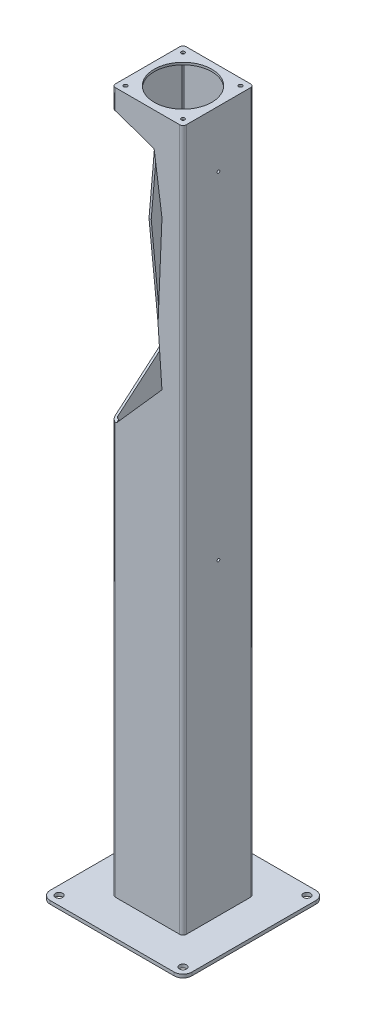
SolidWorks part; units mm, degrees
ref_plane "Front Plane" through (0, 0, 0) normal (0, 0, 1) x (1, 0, 0)
ref_plane "Top Plane" through (0, 0, 0) normal (0, 1, 0) x (1, 0, 0)
ref_plane "Right Plane" through (0, 0, 0) normal (1, 0, 0) x (0, 0, -1)
sketch "Sketch1" plane through (0, 0, 0) normal (0, 1, 0) x (1, 0, 0)
  line L1 (-88.9, 101.6) -> (88.9, 101.6)
  line L2 (-101.6, 88.9) -> (-101.6, -88.9)
  line L3 (-88.9, -101.6) -> (88.9, -101.6)
  line L4 (101.6, 88.9) -> (101.6, -88.9)
  arc A0 (-101.6, -88.9) -> (-88.9, -101.6) centre (-88.9, -88.9) ccw
  arc A1 (88.9, -101.6) -> (101.6, -88.9) centre (88.9, -88.9) ccw
  arc A2 (88.9, 101.6) -> (101.6, 88.9) centre (88.9, 88.9) cw
  arc A3 (-88.9, 101.6) -> (-101.6, 88.9) centre (-88.9, 88.9) ccw
  circle A4 centre (-88.9, 88.9) radius 5.207
  circle A5 centre (88.9, 88.9) radius 5.207
  circle A6 centre (88.9, -88.9) radius 5.207
  circle A7 centre (-88.9, -88.9) radius 5.207
  point P4 (0, 101.6)
  point P5 (-101.6, 0)
  point P9 (-101.6, -101.6)
  point P16 (-101.6, 101.6)
  dimension "D2" = 12.7
  dimension "D3" = 10.414
  dimension "D1" = 203.2
extrude "Boss-Extrude1" add sketch "Sketch1" along normal blind 4.7752
sketch "Sketch2" plane through (0, 4.7752, 0) normal (0, 1, 0) x (1, 0, 0)
  line L1 (-45.974, 50.8) -> (45.974, 50.8)
  line L2 (-50.8, 45.974) -> (-50.8, -45.974)
  line L3 (-45.974, -50.8) -> (45.974, -50.8)
  line L4 (50.8, 45.974) -> (50.8, -45.974)
  arc A0 (45.974, -50.8) -> (50.8, -45.974) centre (45.974, -45.974) ccw
  arc A1 (-50.8, -45.974) -> (-45.974, -50.8) centre (-45.974, -45.974) ccw
  arc A2 (-45.974, 50.8) -> (-50.8, 45.974) centre (-45.974, 45.974) ccw
  arc A3 (45.974, 50.8) -> (50.8, 45.974) centre (45.974, 45.974) cw
  point P8 (-50.8, -50.8)
  point P11 (-50.8, 50.8)
  point P14 (0, 50.8)
  point P16 (-50.8, 0)
  dimension "D2" = 4.826
  dimension "D1" = 101.6
extrude "Boss-Extrude2" add sketch "Sketch2" along normal blind 1005.84
shell "Shell2" thickness 3.175
sketch "Sketch3" plane through (0, 1010.6152, 0) normal (0, 1, 0) x (1, 0, 0)
  circle A0 centre (0, 0) radius 41.275
  dimension "D1" = 82.55
extrude "Cut-Extrude1" cut sketch "Sketch3" against normal through all
hole_wizard "Tap Drill for 1/4-20 Tap1" positions "Sketch4" profile "Sketch5" hole size "1/4-20" standard "ANSI Inch"
sketch "Sketch4" plane through (0, 1010.6152, 0) normal (0, 1, 0) x (1, 0, 0)
  line L0 (-41.275, -41.275) -> (-41.275, 41.275) construction
  line L1 (-41.275, 41.275) -> (41.275, 41.275) construction
  point P0 (-41.275, 41.275)
  point P2 (41.275, 41.275)
  point P4 (41.275, -41.275)
  point P6 (-41.275, -41.275)
  point P21 (-41.275, 0)
  point P22 (0, 41.275)
  dimension "D1" = 82.55
  dimension "D2" = 82.55
sketch "Sketch5" plane through (-41.275, 1010.6152, -41.275) normal (1, 0, 0) x (0, 0, 1)
  line L0 (0, 0) -> (0, 1010.6152)
  line L1 (0, 1010.6152) -> (2.5527, 1010.6152)
  line L2 (2.5527, 1010.6152) -> (2.5527, 0)
  line L5 (2.5527, 0) -> (0, 0)
  line L11 (0, -6.35) -> (0, 107.95) construction
  dimension "Thru Hole Dia." = 5.1054
  dimension "Thru Hole Depth" = 1010.6152
hole_wizard "Tap Drill for #10-32 Tap1" positions "Sketch6" profile "Sketch7" hole size "#10-32" standard "ANSI Inch"
sketch "Sketch6" plane through (50.8, 0, 0) normal (1, 0, 0) x (0, 0, -1)
  line L0 (-45.974, 1010.6152) -> (45.974, 1010.6152) construction
  point P0 (0, 929.3352)
  point P2 (0, 446.7352)
  dimension "D1" = 81.28
  dimension "D2" = 482.6
sketch "Sketch7" plane through (50.8, 929.3352, 0) normal (0, 1, 0) x (0, 0, -1)
  line L0 (0, 0) -> (0, 3.175)
  line L1 (0, 3.175) -> (2.0193, 3.175)
  line L2 (2.0193, 3.175) -> (2.0193, 0)
  line L5 (2.0193, 0) -> (0, 0)
  line L11 (0, -6.35) -> (0, 107.95) construction
  dimension "Thru Hole Dia." = 4.0386
  dimension "Thru Hole Depth" = 3.175
sketch "Sketch13" plane through (-50.8, 0, 0) normal (-1, 0, 0) x (0, 0, 1)
  line L0 (50.8, 981.7342) -> (6.8297, 968.3337)
  line L1 (50.8, 1010.6152) -> (50.8, 4.7752) construction
  line L2 (6.8297, 968.3337) -> (-10.8936, 913.4347)
  line L3 (-10.8936, 913.4347) -> (-2.032, 819.6309)
  line L4 (-2.032, 819.6309) -> (-17.81, 653.6371)
  line L5 (-17.81, 653.6371) -> (50.8, 595.0824)
  line L6 (50.8, 595.0824) -> (50.8, 981.7342)
extrude "Cut-Extrude3" cut sketch "Sketch13" against normal blind 6.35
sketch "Sketch14" plane through (0, 0, 50.8) normal (0, 0, 1) x (1, 0, 0)
  line L0 (-45.212, 981.7342) -> (9.4125, 962.2759)
  line L1 (-44.45, 981.7342) -> (-45.974, 981.7342) construction
  line L2 (9.4125, 962.2759) -> (20.615, 882.4221)
  line L3 (20.615, 882.4221) -> (15.0138, 747.9379)
  line L4 (15.0138, 747.9379) -> (20.615, 668.5207)
  line L5 (20.615, 668.5207) -> (-44.45, 595.0824)
  line L6 (-44.45, 595.0824) -> (-45.212, 981.7342)
extrude "Cut-Extrude4" cut sketch "Sketch14" against normal blind 6.35
sketch "Sketch8" plane through (-50.8, 0, 0) normal (-1, 0, 0) x (0, 0, 1)
  line L0 (-45.974, 1010.6152) -> (45.974, 1010.6152) construction
  circle A0 centre (0, 929.3352) radius 26.543
  dimension "D1" = 53.086
  dimension "D2" = 81.28
extrude "Cut-Extrude2" [suppressed] cut sketch "Sketch8" against normal up to next
hole_wizard "Tap Drill for 1/4-20 Tap2" positions "Sketch11" profile "Sketch12" hole size "1/4-20" standard "ANSI Inch"
sketch "Sketch11" [suppressed] plane through (-50.8, 0, 0) normal (-1, 0, 0) x (0, 0, 1)
  line L0 (-34.925, 967.4352) -> (34.925, 967.4352) construction
  circle A0 centre (0, 929.3352) radius 26.543 construction
  point P0 (-34.925, 967.4352)
  point P2 (34.925, 967.4352)
  point P4 (34.925, 649.9352)
  point P6 (-34.925, 649.9352)
  point P8 (-34.925, 516.5852)
  point P10 (34.925, 516.5852)
  point P12 (34.925, 65.7352)
  point P14 (-34.925, 65.7352)
  point P24 (0, 967.4352)
  dimension "D2" = 38.1
  dimension "D1" = 69.85
  dimension "D3" = 317.5
  dimension "D4" = 450.85
  dimension "D5" = 901.7
sketch "Sketch12" plane through (-50.8, 967.4352, -34.925) normal (0, 1, 0) x (0, 0, 1)
  line L0 (0, 0) -> (0, 3.175)
  line L1 (0, 3.175) -> (2.5527, 3.175)
  line L2 (2.5527, 3.175) -> (2.5527, 0)
  line L5 (2.5527, 0) -> (0, 0)
  line L11 (0, -6.35) -> (0, 107.95) construction
  dimension "Thru Hole Dia." = 5.1054
  dimension "Thru Hole Depth" = 3.175
